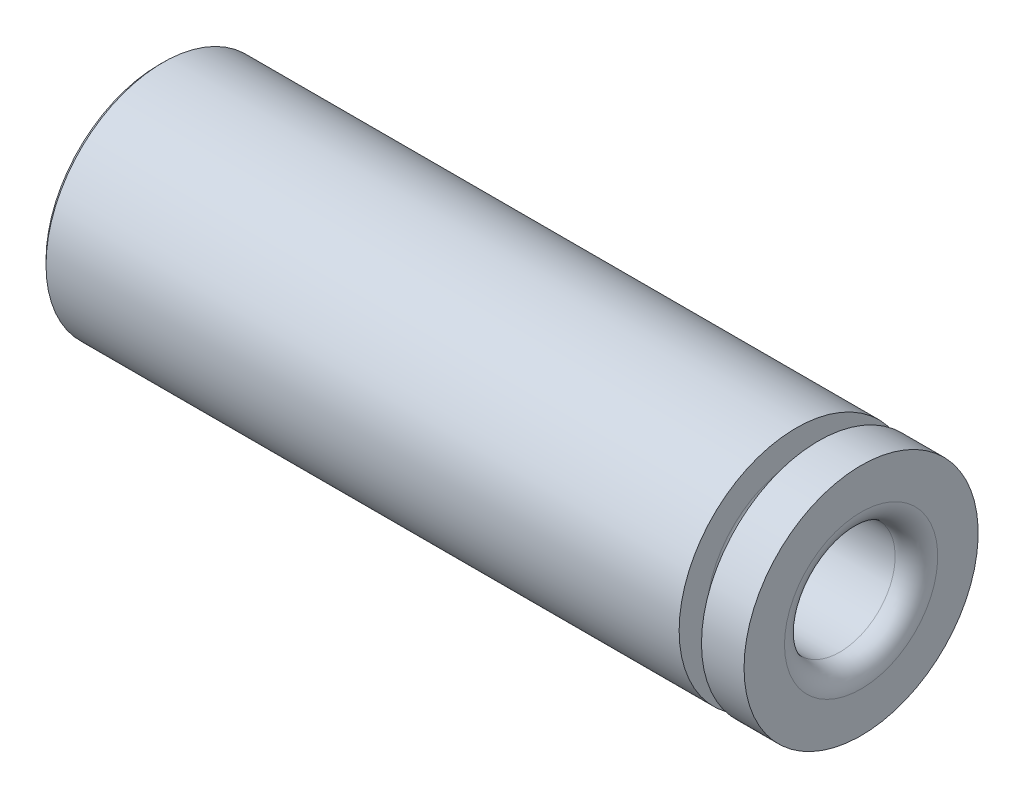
SolidWorks part; units mm, degrees
ref_plane "Plan de face" through (0, 0, 0) normal (0, 0, 1) x (1, 0, 0)
ref_plane "Plan de dessus" through (0, 0, 0) normal (0, 1, 0) x (1, 0, 0)
ref_plane "Plan de droite" through (0, 0, 0) normal (1, 0, 0) x (0, 0, -1)
sketch "Esquisse1" plane through (0, 0, 0) normal (0, 0, 1) x (1, 0, 0)
  line L0 (0, 0) -> (33, 0) construction
  line L1 (0, 5.5) -> (0, 4.35)
  line L2 (0, 4.35) -> (6, 4.35)
  line L3 (6, 4.35) -> (6, 2.6)
  line L4 (6, 2.6) -> (33, 2.6)
  line L5 (33, 2.6) -> (33, 5.5)
  line L6 (33, 5.5) -> (31, 5.5)
  line L7 (31, 5.5) -> (31, 4)
  line L8 (31, 4) -> (29.95, 4)
  line L9 (29.95, 4) -> (29.95, 5.5)
  line L10 (29.95, 5.5) -> (0, 5.5)
  dimension "D1" = 5.2
  dimension "D2" = 8.7
  dimension "D3" = 11
  dimension "D4" = 8
  dimension "D5" = 2
  dimension "D6" = 1.05
  dimension "D7" = 6
  dimension "D8" = 33
revolve "Révolution1" add sketch "Esquisse1" angle 360 about L0
fillet "Congé1" radius 1 1 edges at (33, 0, 2.6)
fillet "Congé2" radius 0.2 1 edges at (6, 0, 4.35)
chamfer "Chanfrein1" distance 0.2 angle 45 1 edges at (0, 0, 5.5)
chamfer "Chanfrein2" distance 0.3 angle 45 1 edges at (0, 0, 4.35)
fillet "Fillet1" radius 0.2 2 edges at (29.95, 0, 4) (31, 0, 4)
